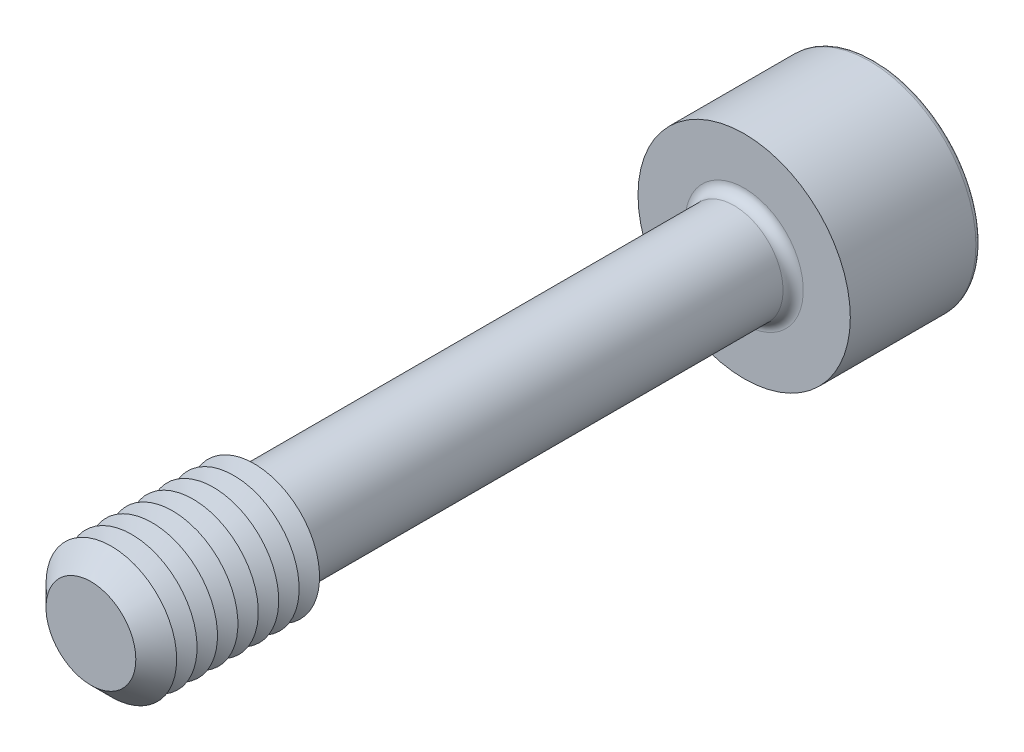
SolidWorks part; units mm, degrees
ref_plane "Front Plane" through (0, 0, 0) normal (0, 0, 1) x (1, 0, 0)
ref_plane "Top Plane" through (0, 0, 0) normal (0, 1, 0) x (1, 0, 0)
ref_plane "Right Plane" through (0, 0, 0) normal (1, 0, 0) x (0, 0, -1)
sketch "Sketch1" plane through (0, 0, 0) normal (0, 0, 1) x (1, 0, 0)
  circle A0 centre (0, 0) radius 3
  dimension "D1" = 6
extrude "Extrude1" add sketch "Sketch1" along normal mid plane 40
sketch "Sketch2" plane through (0, 0, 0) normal (1, 0, 0) x (0, 0, -1)
  line L0 (-20, 0) -> (-20, 4)
  line L1 (-20, 3) -> (-20, -3) construction
  line L2 (-20, 4) -> (-10, 4)
  line L3 (-10, 4) -> (-9.4226, 3)
  line L4 (20, 3) -> (-20, 3) construction
  line L5 (-9.4226, 3) -> (-9.4226, 0)
  line L6 (-9.4226, 0) -> (-20, 0)
  dimension "D1" = 4
  dimension "D2" = 120
  dimension "D3" = 10
revolve "Revolve1" add sketch "Sketch2" angle 360 about L6
chamfer "Chamfer1" distance 1.25 angle 45 1 edges at (0, 4, 20)
sketch "Sketch3" plane through (0, 0, -20) normal (0, 0, -1) x (-1, 0, 0)
  circle A0 centre (0, 0) radius 6.5
  dimension "D1" = 13
extrude "Extrude2" add sketch "Sketch3" along normal blind 8
sketch "Sketch4" plane through (-13.7, 0, -28) normal (0, 0, 1) x (1, 0, 0)
  line L2 (11.9679, -3) -> (15.4321, -3)
  line L3 (15.4321, -3) -> (17.1641, 0)
  line L4 (17.1641, 0) -> (15.4321, 3)
  line L6 (15.4321, 3) -> (11.9679, 3)
  line L7 (11.9679, 3) -> (10.2359, 0)
  line L8 (10.2359, 0) -> (11.9679, -3)
  circle A0 centre (13.7, 0) radius 3 construction
  dimension "D1" = 6
extrude "Extrude3" cut sketch "Sketch4" along normal blind 6
fillet "Fillet1" radius 0.62 1 edges at (-3, 0, -20)
fillet "Fillet2" radius 0.31 1 edges at (-6.5, 0, -28)
sketch "Sketch5" plane through (0, 0, 0) normal (1, 0, 0) x (0, 0, -1)
  line L0 (22, 0) -> (22, -3)
  line L1 (22, -3) -> (20.2679, 0)
  line L2 (20.2679, 0) -> (22, 0)
  dimension "D1" = 30
revolve "Cut-Revolve1" cut sketch "Sketch5" angle 360 about L2
sketch "Sketch6" plane through (0, 0, 0) normal (1, 0, 0) x (0, 0, -1)
  line L0 (1.332, 0) -> (-13.289, 0) construction
sketch "Sketch7" plane through (0, 0, 0) normal (1, 0, 0) x (0, 0, -1)
  line L0 (-10, 4) -> (-10.625, 2.9175)
  line L1 (-10.625, 2.9175) -> (-11.25, 4)
  line L2 (-10, 4) -> (-18.75, 4) construction
  line L3 (-11.25, 4) -> (-10, 4)
  dimension "D1" = 1.25
revolve "Cut-Revolve2" cut sketch "Sketch7" angle 360 about L0
pattern_linear "LPattern1" count 7 spacing 1.25 along (0, 0, 1) of "Cut-Revolve2"
